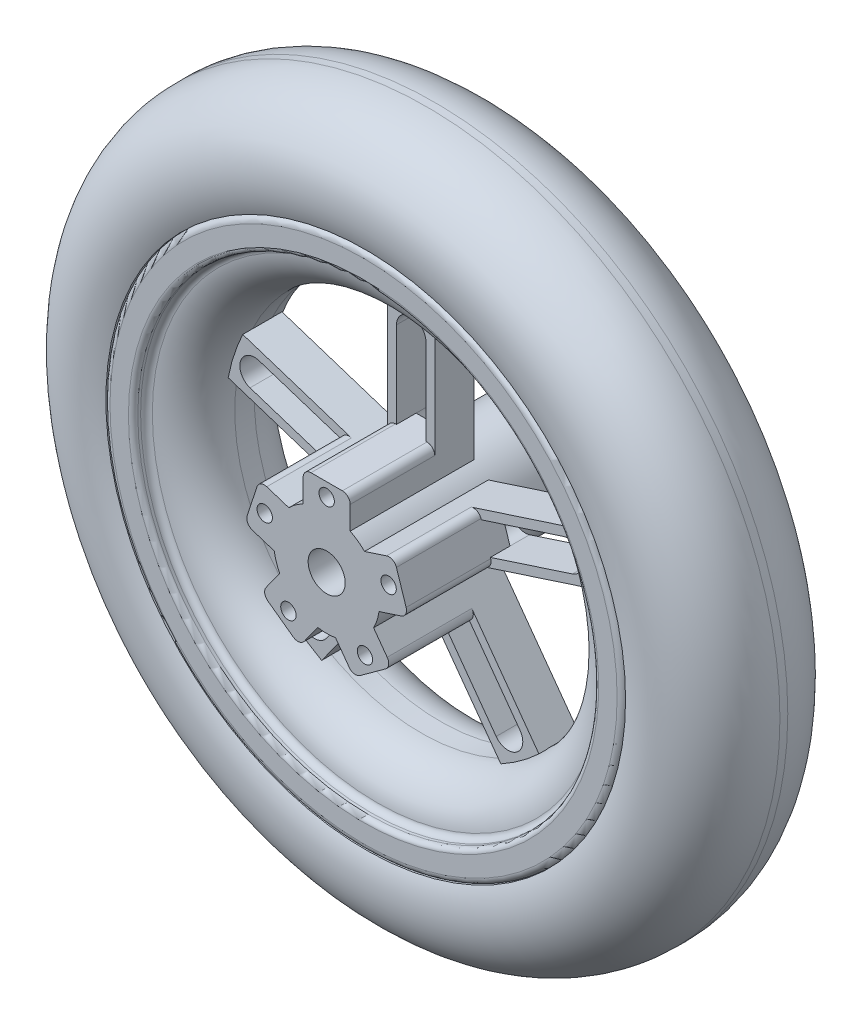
SolidWorks part; units mm, degrees
ref_plane "Front Plane" through (0, 0, 0) normal (0, 0, 1) x (1, 0, 0)
ref_plane "Top Plane" through (0, 0, 0) normal (0, 1, 0) x (1, 0, 0)
ref_plane "Right Plane" through (0, 0, 0) normal (1, 0, 0) x (0, 0, -1)
sketch "Sketch1" plane through (0, 0, 0) normal (0, 0, 1) x (1, 0, 0)
  line L0 (0, 0) -> (0, 17.145) construction
  line L1 (0, 17.145) -> (0, 60.325) construction
  line L2 (0, 74.6125) -> (0, 84.1375) construction
  line L3 (0, 84.1375) -> (0, 114.3) construction
  line L4 (0, 60.325) -> (0, 74.6125) construction
  circle A0 centre (0, 0) radius 6
  circle A1 centre (0, 0) radius 17.145
  circle A2 centre (0, 0) radius 74.6125
  circle A3 centre (0, 0) radius 84.1375
  circle A4 centre (0, 0) radius 114.3
  circle A5 centre (0, 0) radius 60.325
  dimension "D1" = 12
  dimension "D2" = 34.29
  dimension "D3" = 149.225
  dimension "D4" = 168.275
  dimension "D5" = 9.525
  dimension "D6" = 228.6
  dimension "D7" = 120.65
sketch "Sketch3" plane through (0, 0, 0) normal (1, 0, 0) x (0, 0, -1)
  line L0 (0, 60.325) -> (-3.175, 60.325)
  line L1 (0, 60.325) -> (3.175, 60.325)
  line L2 (-17.4625, 74.6125) -> (-21.7932, 74.6125)
  line L3 (-21.7932, 74.6125) -> (-21.7932, 84.1375)
  line L4 (-21.7932, 84.1375) -> (0, 84.1375)
  line L5 (21.7932, 84.1375) -> (21.7932, 74.6125)
  line L6 (21.7932, 74.6125) -> (17.4625, 74.6125)
  line L7 (0, 84.1375) -> (21.7932, 84.1375)
  line L8 (0, 114.3) -> (1.27, 114.3)
  line L9 (0, 0) -> (0, 25.1266) construction
  line L10 (0, 17.145) -> (0, 60.325) construction
  line L11 (0, 84.1375) -> (0, 114.3) construction
  line L12 (0, 114.3) -> (-1.27, 114.3)
  line L13 (0, 0) -> (32.9692, 0) construction
  line L14 (0, 0) -> (-33.7312, 0) construction
  arc A0 (-3.175, 60.325) -> (-17.4625, 74.6125) centre (-3.175, 74.6125) cw
  arc A1 (3.175, 60.325) -> (17.4625, 74.6125) centre (3.175, 74.6125) ccw
  arc A2 (1.27, 114.3) -> (21.0852, 84.1375) centre (1.27, 92.71) cw
  arc A3 (-1.27, 114.3) -> (-21.0852, 84.1375) centre (-1.27, 92.71) ccw
  dimension "D4" = 21.59
  dimension "D1" = 43.5864
  dimension "D2" = 6.35
  dimension "D3" = 2.54
  dimension "D5" = 66.7004
  dimension "D6" = 11.176
  dimension "D7" = 11.938
sketch "Sketch4" plane through (0, 0, 0) normal (1, 0, 0) x (0, 0, -1)
  line L0 (0, 60.325) -> (3.175, 60.325) construction
  line L1 (21.7932, 74.6125) -> (17.4625, 74.6125) construction
  line L2 (21.7932, 84.1375) -> (21.7932, 74.6125) construction
  line L3 (0, 84.1375) -> (21.7932, 84.1375) construction
  line L4 (-21.7932, 84.1375) -> (0, 84.1375) construction
  line L5 (-21.7932, 74.6125) -> (-21.7932, 84.1375) construction
  line L6 (-17.4625, 74.6125) -> (-21.7932, 74.6125) construction
  line L8 (0, 60.325) -> (3.175, 60.325)
  line L9 (21.7932, 74.6125) -> (17.4625, 74.6125)
  line L10 (21.7932, 84.1375) -> (21.7932, 74.6125)
  line L11 (0, 84.1375) -> (21.7932, 84.1375)
  line L12 (-21.7932, 84.1375) -> (0, 84.1375)
  line L13 (-21.7932, 74.6125) -> (-21.7932, 84.1375)
  line L14 (-17.4625, 74.6125) -> (-21.7932, 74.6125)
  line L16 (0, 60.325) -> (-3.175, 60.325) construction
  line L17 (0, 60.325) -> (-3.175, 60.325)
  line L18 (0, 0) -> (19.3659, 0) construction
  arc A0 (3.175, 60.325) -> (17.4625, 74.6125) centre (3.175, 74.6125) ccw construction
  arc A1 (-17.4625, 74.6125) -> (-3.175, 60.325) centre (-3.175, 74.6125) ccw construction
  arc A2 (3.175, 60.325) -> (17.4625, 74.6125) centre (3.175, 74.6125) ccw
  arc A3 (-17.4625, 74.6125) -> (-3.175, 60.325) centre (-3.175, 74.6125) ccw
revolve "Revolve1" add sketch "Sketch4" angle 360 about L18
sketch "Sketch5" plane through (0, 0, 0) normal (1, 0, 0) x (0, 0, -1)
  line L0 (0, 84.1375) -> (21.7932, 84.1375) construction
  line L1 (0, 114.3) -> (1.27, 114.3) construction
  line L2 (0, 114.3) -> (-1.27, 114.3) construction
  line L3 (-21.7932, 84.1375) -> (0, 84.1375) construction
  line L4 (0, 84.1375) -> (21.0852, 84.1375)
  line L5 (0, 114.3) -> (1.27, 114.3)
  line L6 (0, 114.3) -> (-1.27, 114.3)
  line L7 (-21.0852, 84.1375) -> (0, 84.1375)
  line L8 (0, 0) -> (17.8199, 0) construction
  arc A0 (21.0852, 84.1375) -> (1.27, 114.3) centre (1.27, 92.71) ccw construction
  arc A1 (-1.27, 114.3) -> (-21.0852, 84.1375) centre (-1.27, 92.71) ccw construction
  arc A2 (21.0852, 84.1375) -> (1.27, 114.3) centre (1.27, 92.71) ccw
  arc A3 (-1.27, 114.3) -> (-21.0852, 84.1375) centre (-1.27, 92.71) ccw
revolve "Revolve2" add sketch "Sketch5" angle 360 about L8
fillet "Fillet1" radius 2.032 2 edges at (84.1375, 0, -21.7932) (84.1375, 0, 21.7932)
fillet "Fillet2" radius 2.032 2 edges at (74.6125, 0, -17.4625) (74.6125, 0, 17.4625)
fillet "Fillet3" radius 1.524 2 edges at (74.6125, 0, 21.7932) (74.6125, 0, -21.7932)
sketch "Sketch6" plane through (0, 0, 0) normal (0, 0, 1) x (1, 0, 0)
  line L0 (0, 0) -> (0, 60.325) construction
  line L1 (0, 0) -> (57.3725, 18.6415) construction
  line L2 (0, 0) -> (-57.3725, 18.6415) construction
  line L3 (0, 0) -> (-35.4581, -48.804) construction
  line L4 (0, 0) -> (35.4581, -48.804) construction
  line L5 (7.62, 15.3586) -> (7.62, 59.8418)
  line L6 (-7.62, 59.8418) -> (-7.62, 15.3586)
  line L7 (-12.2522, 11.9931) -> (-54.5582, 25.7392)
  line L8 (-16.9616, -2.501) -> (-59.2676, 11.2451)
  line L9 (-2.8628, -16.9043) -> (-29.0094, -52.892)
  line L10 (-15.1923, -7.9464) -> (-41.3388, -43.9341)
  line L11 (2.8628, -16.9043) -> (29.0094, -52.892)
  line L12 (15.1923, -7.9464) -> (41.3388, -43.9341)
  line L13 (-54.5582, 25.7392) -> (-59.2676, 11.2451)
  line L14 (12.2522, 11.9931) -> (54.5582, 25.7392)
  line L15 (16.9616, -2.501) -> (59.2676, 11.2451)
  line L16 (-7.62, 59.8418) -> (7.62, 59.8418)
  line L17 (54.5582, 25.7392) -> (59.2676, 11.2451)
  line L18 (29.0094, -52.892) -> (41.3388, -43.9341)
  line L19 (41.3388, -43.9341) -> (41.39, -43.8637)
  line L20 (-41.3388, -43.9341) -> (-29.0094, -52.892)
  line L21 (-31.3525, -43.153) -> (-14.9297, -20.549) construction
  line L22 (-35.2054, -40.3536) -> (-18.7827, -17.7497)
  line L23 (-27.4995, -45.9523) -> (-11.0768, -23.3484)
  line L24 (31.3525, -43.153) -> (14.9297, -20.549) construction
  line L25 (27.4995, -45.9523) -> (11.0768, -23.3484)
  line L26 (35.2054, -40.3536) -> (18.7827, -17.7497)
  line L27 (-24.1568, 7.849) -> (-50.7294, 16.483) construction
  line L28 (-25.6285, 3.3196) -> (-52.201, 11.9536)
  line L29 (-22.6851, 12.3784) -> (-49.2577, 21.0124)
  line L30 (24.1568, 7.849) -> (50.7294, 16.483) construction
  line L31 (22.6851, 12.3784) -> (49.2577, 21.0124)
  line L32 (25.6285, 3.3196) -> (52.201, 11.9536)
  line L33 (0, 25.4) -> (0, 53.34) construction
  line L34 (-4.7625, 25.4) -> (-4.7625, 53.34)
  line L35 (4.7625, 25.4) -> (4.7625, 53.34)
  line L36 (24.1568, 7.849) -> (26.5115, 0.602)
  line L37 (24.1568, 7.849) -> (21.8021, 15.0961)
  line L38 (0, 25.4) -> (-7.62, 25.4)
  line L39 (-24.1568, 7.849) -> (-21.8021, 15.0961)
  line L40 (-24.1568, 7.849) -> (-26.5115, 0.602)
  line L41 (-14.9297, -20.549) -> (-21.0945, -16.0701)
  line L42 (-14.9297, -20.549) -> (-8.765, -25.028)
  line L43 (14.9297, -20.549) -> (8.765, -25.028)
  line L44 (14.9297, -20.549) -> (21.0945, -16.0701)
  line L45 (0, 25.4) -> (7.62, 25.4)
  circle A0 centre (0, 0) radius 17.145 construction
  circle A1 centre (0, 0) radius 60.325 construction
  circle A2 centre (0, 0) radius 17.145
  circle A3 centre (0, 0) radius 60.325
  arc A4 (-35.2054, -40.3536) -> (-27.4995, -45.9523) centre (-31.3525, -43.153) ccw
  arc A5 (-11.0768, -23.3484) -> (-18.7827, -17.7497) centre (-14.9297, -20.549) ccw
  arc A6 (27.4995, -45.9523) -> (35.2054, -40.3536) centre (31.3525, -43.153) ccw
  arc A7 (18.7827, -17.7497) -> (11.0768, -23.3484) centre (14.9297, -20.549) ccw
  arc A8 (-25.6285, 3.3196) -> (-22.6851, 12.3784) centre (-24.1568, 7.849) ccw
  arc A9 (-49.2577, 21.0124) -> (-52.201, 11.9536) centre (-50.7294, 16.483) ccw
  arc A10 (22.6851, 12.3784) -> (25.6285, 3.3196) centre (24.1568, 7.849) ccw
  arc A11 (52.201, 11.9536) -> (49.2577, 21.0124) centre (50.7294, 16.483) ccw
  arc A12 (-4.7625, 25.4) -> (4.7625, 25.4) centre (0, 25.4) ccw
  arc A13 (4.7625, 53.34) -> (-4.7625, 53.34) centre (0, 53.34) ccw
  circle A14 centre (0, 0) radius 25.4 construction
  circle A15 centre (0, 21.082) radius 2.4892
  circle A16 centre (20.0502, 6.5147) radius 2.4892
  circle A17 centre (12.3917, -17.0557) radius 2.4892
  circle A18 centre (-12.3917, -17.0557) radius 2.4892
  circle A19 centre (-20.0502, 6.5147) radius 2.4892
  circle A20 centre (0, 0) radius 21.082 construction
  point P36 (-23.1411, -31.851)
  point P41 (23.1411, -31.851)
  point P48 (-37.4431, 12.166)
  point P55 (37.4431, 12.166)
  point P62 (0, 39.37)
  dimension "D9" = 4.9784
  dimension "D10" = 40.1003
  dimension "D11" = 42.164
  dimension "D1" = 72
  dimension "D2" = 72
  dimension "D3" = 72
  dimension "D4" = 72
  dimension "D5" = 15.24
  dimension "D6" = 9.525
  dimension "D7" = 25.4
  dimension "D8" = 27.94
sketch "Sketch7" plane through (0, 0, 0) normal (0, 0, 1) x (1, 0, 0)
  circle A0 centre (0, 0) radius 17.145 construction
  circle A1 centre (0, 0) radius 6 construction
  circle A2 centre (0, 0) radius 17.145
  circle A3 centre (0, 0) radius 6
extrude "Boss-Extrude1" add sketch "Sketch7" along normal up to vertex (33.7312 mm away) and the other way up to vertex (32.9692 mm away) separate body
sketch "Sketch10" plane through (0, 0, 0) normal (0, 0, 1) x (1, 0, 0)
  line L0 (-27.4995, -45.9523) -> (-11.0768, -23.3484) construction
  line L1 (-35.2054, -40.3536) -> (-18.7827, -17.7497) construction
  line L2 (27.4995, -45.9523) -> (11.0768, -23.3484) construction
  line L3 (35.2054, -40.3536) -> (18.7827, -17.7497) construction
  line L4 (25.6285, 3.3196) -> (52.201, 11.9536) construction
  line L5 (22.6851, 12.3784) -> (49.2577, 21.0124) construction
  line L6 (4.7625, 25.4) -> (4.7625, 53.34) construction
  line L7 (-4.7625, 25.4) -> (-4.7625, 53.34) construction
  line L8 (-22.6851, 12.3784) -> (-49.2577, 21.0124) construction
  line L9 (-25.6285, 3.3196) -> (-52.201, 11.9536) construction
  line L10 (-12.2522, 11.9931) -> (-54.5582, 25.7392) construction
  line L11 (-16.9616, -2.501) -> (-59.2676, 11.2451) construction
  line L12 (-7.62, 59.8418) -> (-7.62, 15.3586) construction
  line L13 (7.62, 15.3586) -> (7.62, 59.8418) construction
  line L14 (12.2522, 11.9931) -> (54.5582, 25.7392) construction
  line L15 (16.9616, -2.501) -> (59.2676, 11.2451) construction
  line L16 (15.1923, -7.9464) -> (41.3388, -43.9341) construction
  line L17 (2.8628, -16.9043) -> (29.0094, -52.892) construction
  line L18 (-2.8628, -16.9043) -> (-29.0094, -52.892) construction
  line L19 (-15.1923, -7.9464) -> (-41.3388, -43.9341) construction
  line L20 (-27.4995, -45.9523) -> (-11.0768, -23.3484)
  line L21 (-35.2054, -40.3536) -> (-18.7827, -17.7497)
  line L22 (27.4995, -45.9523) -> (11.0768, -23.3484)
  line L23 (35.2054, -40.3536) -> (18.7827, -17.7497)
  line L24 (25.6285, 3.3196) -> (52.201, 11.9536)
  line L25 (22.6851, 12.3784) -> (49.2577, 21.0124)
  line L26 (4.7625, 25.4) -> (4.7625, 53.34)
  line L27 (-4.7625, 25.4) -> (-4.7625, 53.34)
  line L28 (-22.6851, 12.3784) -> (-49.2577, 21.0124)
  line L29 (-25.6285, 3.3196) -> (-52.201, 11.9536)
  line L30 (-12.2522, 11.9931) -> (-54.5582, 25.7392)
  line L31 (-16.9616, -2.501) -> (-59.2676, 11.2451)
  line L32 (-7.62, 59.8418) -> (-7.62, 15.3586)
  line L33 (7.62, 15.3586) -> (7.62, 59.8418)
  line L34 (12.2522, 11.9931) -> (54.5582, 25.7392)
  line L35 (16.9616, -2.501) -> (59.2676, 11.2451)
  line L36 (15.1923, -7.9464) -> (41.3388, -43.9341)
  line L37 (2.8628, -16.9043) -> (29.0094, -52.892)
  line L38 (-2.8628, -16.9043) -> (-29.0094, -52.892)
  line L39 (-15.1923, -7.9464) -> (-41.3388, -43.9341)
  arc A0 (-11.0768, -23.3484) -> (-18.7827, -17.7497) centre (-14.9297, -20.549) ccw construction
  arc A1 (-35.2054, -40.3536) -> (-27.4995, -45.9523) centre (-31.3525, -43.153) ccw construction
  arc A2 (18.7827, -17.7497) -> (11.0768, -23.3484) centre (14.9297, -20.549) ccw construction
  arc A3 (27.4995, -45.9523) -> (35.2054, -40.3536) centre (31.3525, -43.153) ccw construction
  arc A4 (52.201, 11.9536) -> (49.2577, 21.0124) centre (50.7294, 16.483) ccw construction
  arc A5 (22.6851, 12.3784) -> (25.6285, 3.3196) centre (24.1568, 7.849) ccw construction
  arc A6 (4.7625, 53.34) -> (-4.7625, 53.34) centre (0, 53.34) ccw construction
  arc A7 (-4.7625, 25.4) -> (4.7625, 25.4) centre (0, 25.4) ccw construction
  arc A8 (-49.2577, 21.0124) -> (-52.201, 11.9536) centre (-50.7294, 16.483) ccw construction
  arc A9 (-25.6285, 3.3196) -> (-22.6851, 12.3784) centre (-24.1568, 7.849) ccw construction
  circle A10 centre (0, 0) radius 60.325 construction
  circle A11 centre (0, 0) radius 17.145 construction
  arc A12 (-11.0768, -23.3484) -> (-18.7827, -17.7497) centre (-14.9297, -20.549) ccw
  arc A13 (-35.2054, -40.3536) -> (-27.4995, -45.9523) centre (-31.3525, -43.153) ccw
  arc A14 (18.7827, -17.7497) -> (11.0768, -23.3484) centre (14.9297, -20.549) ccw
  arc A15 (27.4995, -45.9523) -> (35.2054, -40.3536) centre (31.3525, -43.153) ccw
  arc A16 (52.201, 11.9536) -> (49.2577, 21.0124) centre (50.7294, 16.483) ccw
  arc A17 (22.6851, 12.3784) -> (25.6285, 3.3196) centre (24.1568, 7.849) ccw
  arc A18 (4.7625, 53.34) -> (-4.7625, 53.34) centre (0, 53.34) ccw
  arc A19 (-4.7625, 25.4) -> (4.7625, 25.4) centre (0, 25.4) ccw
  arc A20 (-49.2577, 21.0124) -> (-52.201, 11.9536) centre (-50.7294, 16.483) ccw
  arc A21 (-25.6285, 3.3196) -> (-22.6851, 12.3784) centre (-24.1568, 7.849) ccw
  arc A22 (-54.5582, 25.7392) -> (-59.2676, 11.2451) centre (0, 0) ccw
  arc A23 (-12.2522, 11.9931) -> (-16.9616, -2.501) centre (0, 0) ccw
  arc A24 (-41.3388, -43.9341) -> (-29.0094, -52.892) centre (0, 0) ccw
  arc A25 (29.0094, -52.892) -> (41.3388, -43.9341) centre (0, 0) ccw
  arc A26 (59.2676, 11.2451) -> (54.5582, 25.7392) centre (0, 0) ccw
  arc A27 (7.62, 59.8418) -> (-7.62, 59.8418) centre (0, 0) ccw
  arc A28 (7.62, 15.3586) -> (-7.62, 15.3586) centre (0, 0) ccw
  arc A29 (16.9616, -2.501) -> (12.2522, 11.9931) centre (0, 0) ccw
  arc A30 (2.8628, -16.9043) -> (15.1923, -7.9464) centre (0, 0) ccw
  arc A31 (-15.1923, -7.9464) -> (-2.8628, -16.9043) centre (0, 0) ccw
extrude "Boss-Extrude2" add sketch "Sketch10" along normal mid plane 12.7
sketch "Sketch11" plane through (0, 0, 0) normal (0, 0, 1) x (1, 0, 0)
  line L0 (0, 25.4) -> (7.62, 25.4) construction
  line L1 (0, 25.4) -> (-7.62, 25.4) construction
  line L2 (24.1568, 7.849) -> (21.8021, 15.0961) construction
  line L3 (24.1568, 7.849) -> (26.5115, 0.602) construction
  line L4 (14.9297, -20.549) -> (8.765, -25.028) construction
  line L5 (14.9297, -20.549) -> (21.0945, -16.0701) construction
  line L6 (-14.9297, -20.549) -> (-8.765, -25.028) construction
  line L7 (-14.9297, -20.549) -> (-21.0945, -16.0701) construction
  line L8 (-24.1568, 7.849) -> (-26.5115, 0.602) construction
  line L9 (-24.1568, 7.849) -> (-21.8021, 15.0961) construction
  line L10 (-7.62, 59.8418) -> (-7.62, 15.3586) construction
  line L11 (7.62, 15.3586) -> (7.62, 59.8418) construction
  line L12 (12.2522, 11.9931) -> (54.5582, 25.7392) construction
  line L13 (16.9616, -2.501) -> (59.2676, 11.2451) construction
  line L14 (15.1923, -7.9464) -> (41.3388, -43.9341) construction
  line L15 (2.8628, -16.9043) -> (29.0094, -52.892) construction
  line L16 (-2.8628, -16.9043) -> (-29.0094, -52.892) construction
  line L17 (-15.1923, -7.9464) -> (-41.3388, -43.9341) construction
  line L18 (-16.9616, -2.501) -> (-59.2676, 11.2451) construction
  line L19 (-12.2522, 11.9931) -> (-54.5582, 25.7392) construction
  line L20 (0, 25.4) -> (7.62, 25.4)
  line L21 (0, 25.4) -> (-7.62, 25.4)
  line L22 (24.1568, 7.849) -> (21.8021, 15.0961)
  line L23 (24.1568, 7.849) -> (26.5115, 0.602)
  line L24 (14.9297, -20.549) -> (8.765, -25.028)
  line L25 (14.9297, -20.549) -> (21.0945, -16.0701)
  line L26 (-14.9297, -20.549) -> (-8.765, -25.028)
  line L27 (-14.9297, -20.549) -> (-21.0945, -16.0701)
  line L28 (-24.1568, 7.849) -> (-26.5115, 0.602)
  line L29 (-24.1568, 7.849) -> (-21.8021, 15.0961)
  line L30 (-7.62, 25.4) -> (-7.62, 15.3586)
  line L31 (7.62, 15.3586) -> (7.62, 25.4)
  line L32 (12.2522, 11.9931) -> (21.8021, 15.0961)
  line L33 (16.9616, -2.501) -> (26.5115, 0.602)
  line L34 (15.1923, -7.9464) -> (21.0945, -16.0701)
  line L35 (2.8628, -16.9043) -> (8.765, -25.028)
  line L36 (-2.8628, -16.9043) -> (-8.765, -25.028)
  line L37 (-15.1923, -7.9464) -> (-21.0945, -16.0701)
  line L38 (-16.9616, -2.501) -> (-26.5115, 0.602)
  line L39 (-12.2522, 11.9931) -> (-21.8021, 15.0961)
  circle A0 centre (0, 0) radius 17.145 construction
  arc A1 (-12.2522, 11.9931) -> (-16.9616, -2.501) centre (0, 0) ccw
  arc A2 (-15.1923, -7.9464) -> (-2.8628, -16.9043) centre (0, 0) ccw
  arc A3 (2.8628, -16.9043) -> (15.1923, -7.9464) centre (0, 0) ccw
  arc A4 (16.9616, -2.501) -> (12.2522, 11.9931) centre (0, 0) ccw
  arc A5 (7.62, 15.3586) -> (-7.62, 15.3586) centre (0, 0) ccw
  circle A6 centre (0, 21.082) radius 2.4892 construction
  circle A7 centre (-20.0502, 6.5147) radius 2.4892 construction
  circle A8 centre (-12.3917, -17.0557) radius 2.4892 construction
  circle A9 centre (12.3917, -17.0557) radius 2.4892 construction
  circle A10 centre (20.0502, 6.5147) radius 2.4892 construction
  circle A11 centre (0, 21.082) radius 2.4892
  circle A12 centre (-20.0502, 6.5147) radius 2.4892
  circle A13 centre (-12.3917, -17.0557) radius 2.4892
  circle A14 centre (12.3917, -17.0557) radius 2.4892
  circle A15 centre (20.0502, 6.5147) radius 2.4892
extrude "Boss-Extrude3" add sketch "Sketch11" along normal up to surface (33.7312 mm away)
fillet "Fillet4" radius 2.54 10 edges at (21.8021, 15.0961, 20.0406) (26.5115, 0.602, 20.0406) (21.0945, -16.0701, 20.0406) (8.765, -25.028, 20.0406) (-8.765, -25.028, 20.0406) (-21.0945, -16.0701, 20.0406) (-26.5115, 0.602, 20.0406) (-21.8021, 15.0961, 20.0406) (-7.62, 25.4, 20.0406) (7.62, 25.4, 20.0406)
sketch "Sketch12" plane through (0, 0, 0) normal (0, 0, 1) x (1, 0, 0)
  line L0 (0, 0) -> (254, 0)
  line L1 (0, 0) -> (-254, 0)
  dimension "D1" = 254
